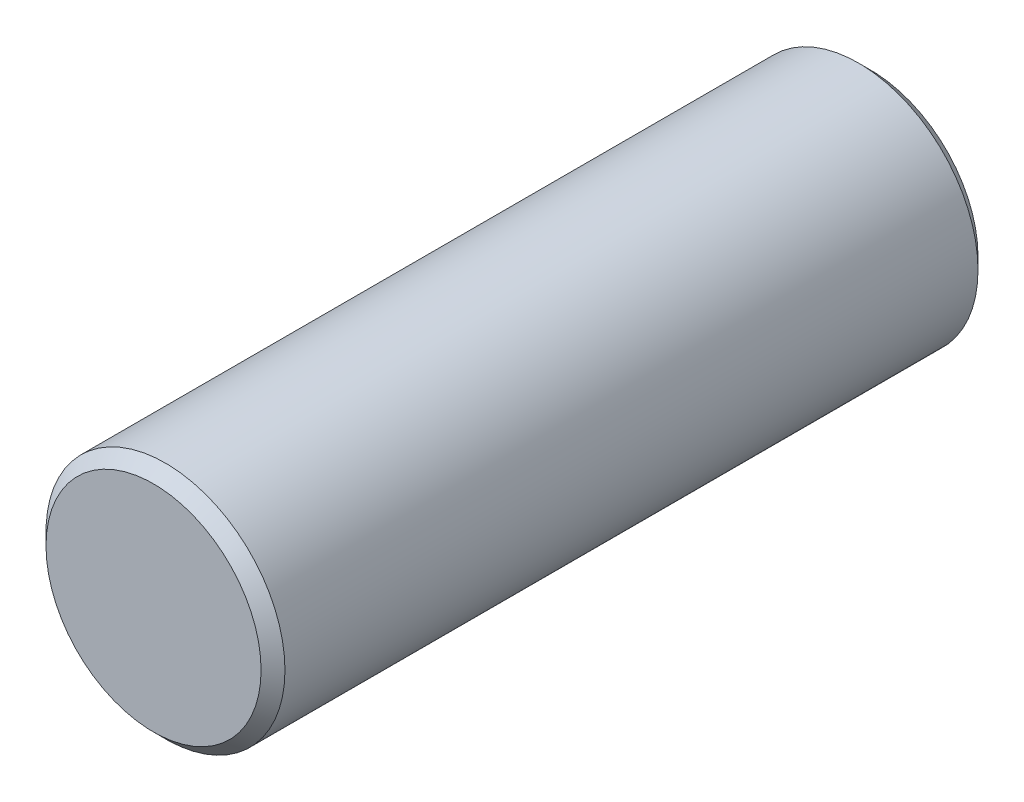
SolidWorks part; units mm, degrees
ref_plane "Frontal" through (0, 0, 0) normal (0, 0, 1) x (1, 0, 0)
ref_plane "Superior" through (0, 0, 0) normal (0, 1, 0) x (1, 0, 0)
ref_plane "Derecha" through (0, 0, 0) normal (1, 0, 0) x (0, 0, -1)
sketch "Croquis1" plane through (0, 0, 0) normal (0, 0, 1) x (1, 0, 0)
  circle A0 centre (0, 0) radius 5
  dimension "D1" = 10
extrude "Extruir1" add sketch "Croquis1" along normal blind 30
chamfer "Chaflán1" distance 0.5 angle 45 2 edges at (5, 0, 0) (5, 0, 30)
